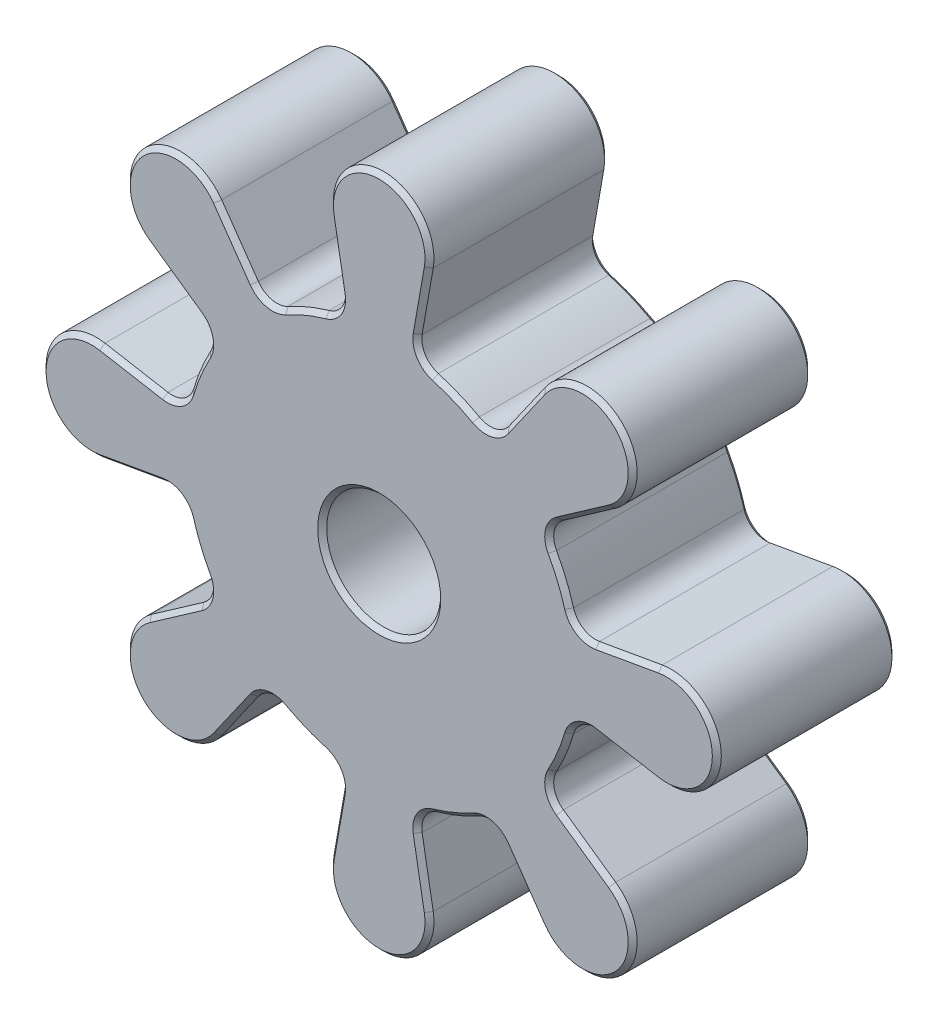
SolidWorks part; units mm, degrees
ref_plane "Спереди" through (0, 0, 0) normal (0, 0, 1) x (1, 0, 0)
ref_plane "Сверху" through (0, 0, 0) normal (0, 1, 0) x (1, 0, 0)
ref_plane "Справа" through (0, 0, 0) normal (1, 0, 0) x (0, 0, -1)
sketch "Эскиз1" plane through (0, 0, 0) normal (0, 0, 1) x (1, 0, 0)
  line L0 (0, 0) -> (0, 16) construction
  line L1 (-2.1401, 12.0127) -> (-2.7575, 15.5138)
  line L2 (2.1401, 12.0127) -> (2.7575, 15.5138)
  line L3 (6.981, 10.0076) -> (9.0201, 12.9197)
  line L4 (10.0076, 6.981) -> (12.9197, 9.0201)
  line L5 (12.0127, 2.1401) -> (15.5138, 2.7575)
  line L6 (12.0127, -2.1401) -> (15.5138, -2.7575)
  line L7 (10.0076, -6.981) -> (12.9197, -9.0201)
  line L8 (6.981, -10.0076) -> (9.0201, -12.9197)
  line L9 (2.1401, -12.0127) -> (2.7575, -15.5138)
  line L10 (-2.1401, -12.0127) -> (-2.7575, -15.5138)
  line L11 (-6.981, -10.0076) -> (-9.0201, -12.9197)
  line L12 (-10.0076, -6.981) -> (-12.9197, -9.0201)
  line L13 (-12.0127, -2.1401) -> (-15.5138, -2.7575)
  line L14 (-12.0127, 2.1401) -> (-15.5138, 2.7575)
  line L15 (-10.0076, 6.981) -> (-12.9197, 9.0201)
  line L16 (-6.981, 10.0076) -> (-9.0201, 12.9197)
  circle A0 centre (0, 0) radius 3.175
  circle A1 centre (0, 0) radius 16 construction
  arc A2 (2.7575, 15.5138) -> (-2.7575, 15.5138) centre (0, 16) ccw
  arc A3 (-3.0399, 10.5716) -> (-5.3258, 9.6248) centre (0, 0) ccw
  arc A4 (2.1401, 12.0127) -> (3.0399, 10.5716) centre (3.3908, 11.7922) ccw
  arc A5 (-2.1401, 12.0127) -> (-3.0399, 10.5716) centre (-3.3908, 11.7922) cw
  arc A6 (6.981, 10.0076) -> (5.3258, 9.6248) centre (5.9406, 10.736) cw
  arc A7 (12.9197, 9.0201) -> (9.0201, 12.9197) centre (11.3137, 11.3137) ccw
  arc A8 (10.0076, 6.981) -> (9.6248, 5.3258) centre (10.736, 5.9406) ccw
  arc A9 (12.0127, 2.1401) -> (10.5716, 3.0399) centre (11.7922, 3.3908) cw
  arc A10 (15.5138, -2.7575) -> (15.5138, 2.7575) centre (16, 0) ccw
  arc A11 (12.0127, -2.1401) -> (10.5716, -3.0399) centre (11.7922, -3.3908) ccw
  arc A12 (10.0076, -6.981) -> (9.6248, -5.3258) centre (10.736, -5.9406) cw
  arc A13 (9.0201, -12.9197) -> (12.9197, -9.0201) centre (11.3137, -11.3137) ccw
  arc A14 (6.981, -10.0076) -> (5.3258, -9.6248) centre (5.9406, -10.736) ccw
  arc A15 (2.1401, -12.0127) -> (3.0399, -10.5716) centre (3.3908, -11.7922) cw
  arc A16 (-2.7575, -15.5138) -> (2.7575, -15.5138) centre (0, -16) ccw
  arc A17 (-2.1401, -12.0127) -> (-3.0399, -10.5716) centre (-3.3908, -11.7922) ccw
  arc A18 (-6.981, -10.0076) -> (-5.3258, -9.6248) centre (-5.9406, -10.736) cw
  arc A19 (-12.9197, -9.0201) -> (-9.0201, -12.9197) centre (-11.3137, -11.3137) ccw
  arc A20 (-10.0076, -6.981) -> (-9.6248, -5.3258) centre (-10.736, -5.9406) ccw
  arc A21 (-12.0127, -2.1401) -> (-10.5716, -3.0399) centre (-11.7922, -3.3908) cw
  arc A22 (-15.5138, 2.7575) -> (-15.5138, -2.7575) centre (-16, 0) ccw
  arc A23 (-12.0127, 2.1401) -> (-10.5716, 3.0399) centre (-11.7922, 3.3908) ccw
  arc A24 (-10.0076, 6.981) -> (-9.6248, 5.3258) centre (-10.736, 5.9406) cw
  arc A25 (-9.0201, 12.9197) -> (-12.9197, 9.0201) centre (-11.3137, 11.3137) ccw
  arc A26 (-6.981, 10.0076) -> (-5.3258, 9.6248) centre (-5.9406, 10.736) ccw
  arc A27 (5.3258, 9.6248) -> (3.0399, 10.5716) centre (0, 0) ccw
  arc A28 (-9.6248, 5.3258) -> (-10.5716, 3.0399) centre (0, 0) ccw
  arc A29 (-10.5716, -3.0399) -> (-9.6248, -5.3258) centre (0, 0) ccw
  arc A30 (-5.3258, -9.6248) -> (-3.0399, -10.5716) centre (0, 0) ccw
  arc A31 (3.0399, -10.5716) -> (5.3258, -9.6248) centre (0, 0) ccw
  arc A32 (9.6248, -5.3258) -> (10.5716, -3.0399) centre (0, 0) ccw
  arc A33 (10.5716, 3.0399) -> (9.6248, 5.3258) centre (0, 0) ccw
  point P11 (1.9314, 10.8291)
  point P14 (-1.9314, 10.8291)
  dimension "D1" = 6.35
  dimension "D2" = 32
  dimension "D3" = 5.6
  dimension "D4" = 22
  dimension "D6" = 1.27
  dimension "D5" = 10
  dimension "D7" = 8
extrude "Бобышка-Вытянуть1" add sketch "Эскиз1" along normal blind 10
chamfer "Фаска1" distance 0.25 angle 45 98 edges at (3.175, 0, 0) (2.4488, 13.7632, 0) (0, 18.8, 0) (-2.4488, 13.7632, 0) (-2.3136, 11.1196, 0) (-4.2095, 10.1627, 0) (-6.2268, 9.4987, 0) (-8.0005, 11.4636, 0) (-13.2936, 13.2936, 0) (-11.4636, 8.0005, 0) (-9.4987, 6.2268, 0) (-10.1627, 4.2095, 0) (-11.1196, 2.3136, 0) (-13.7632, 2.4488, 0) (-18.8, 0, 0) (-13.7632, -2.4488, 0) (-11.1196, -2.3136, 0) (-10.1627, -4.2095, 0) (-9.4987, -6.2268, 0) (-11.4636, -8.0005, 0) (-13.2936, -13.2936, 0) (-8.0005, -11.4636, 0) (-6.2268, -9.4987, 0) (-4.2095, -10.1627, 0) (-2.3136, -11.1196, 0) (-2.4488, -13.7632, 0) (0, -18.8, 0) (2.4488, -13.7632, 0) (2.3136, -11.1196, 0) (4.2095, -10.1627, 0) (6.2268, -9.4987, 0) (8.0005, -11.4636, 0) (13.2936, -13.2936, 0) (11.4636, -8.0005, 0) (9.4987, -6.2268, 0) (10.1627, -4.2095, 0) (11.1196, -2.3136, 0) (13.7632, -2.4488, 0) (18.8, 0, 0) (13.7632, 2.4488, 0) (11.1196, 2.3136, 0) (10.1627, 4.2095, 0) (9.4987, 6.2268, 0) (11.4636, 8.0005, 0) (13.2936, 13.2936, 0) (8.0005, 11.4636, 0) (6.2268, 9.4987, 0) (4.2095, 10.1627, 0) (2.3136, 11.1196, 0) (3.175, 0, 10) (4.2095, 10.1627, 10) (6.2268, 9.4987, 10) (8.0005, 11.4636, 10) (13.2936, 13.2936, 10) (11.4636, 8.0005, 10) (9.4987, 6.2268, 10) (10.1627, 4.2095, 10) (11.1196, 2.3136, 10) (13.7632, 2.4488, 10) (18.8, 0, 10) (13.7632, -2.4488, 10) (11.1196, -2.3136, 10) (10.1627, -4.2095, 10) (9.4987, -6.2268, 10) (11.4636, -8.0005, 10) (13.2936, -13.2936, 10) (8.0005, -11.4636, 10) (6.2268, -9.4987, 10) (4.2095, -10.1627, 10) (2.3136, -11.1196, 10) (2.4488, -13.7632, 10) (0, -18.8, 10) (-2.4488, -13.7632, 10) (-2.3136, -11.1196, 10) (-4.2095, -10.1627, 10) (-6.2268, -9.4987, 10) (-8.0005, -11.4636, 10) (-13.2936, -13.2936, 10) (-11.4636, -8.0005, 10) (-9.4987, -6.2268, 10) (-10.1627, -4.2095, 10) (-11.1196, -2.3136, 10) (-13.7632, -2.4488, 10) (-18.8, 0, 10) (-13.7632, 2.4488, 10) (-11.1196, 2.3136, 10) (-10.1627, 4.2095, 10) (-9.4987, 6.2268, 10) (-11.4636, 8.0005, 10) (-13.2936, 13.2936, 10) (-8.0005, 11.4636, 10) (-6.2268, 9.4987, 10) (-4.2095, 10.1627, 10) (-2.3136, 11.1196, 10) (-2.4488, 13.7632, 10) (0, 18.8, 10) (2.4488, 13.7632, 10) (2.3136, 11.1196, 10)
